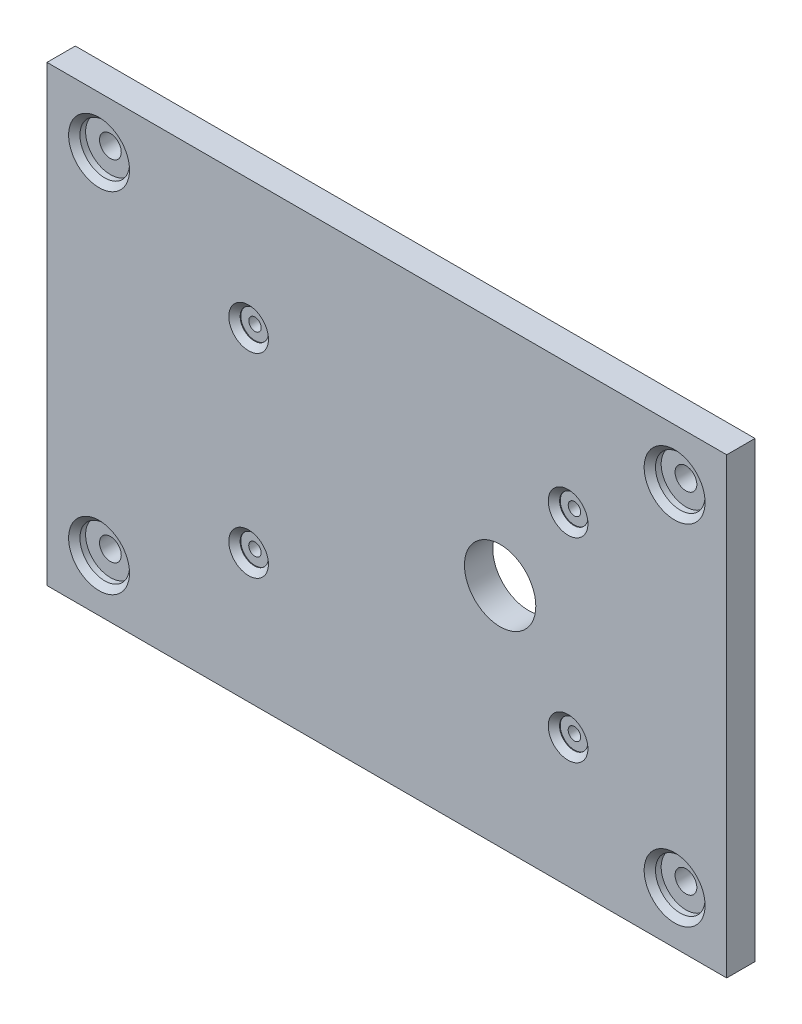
SolidWorks part; units mm, degrees
ref_plane "Front Plane" through (0, 0, 0) normal (0, 0, 1) x (1, 0, 0)
ref_plane "Top Plane" through (0, 0, 0) normal (0, 1, 0) x (1, 0, 0)
ref_plane "Right Plane" through (0, 0, 0) normal (1, 0, 0) x (0, 0, -1)
sketch "Sketch1" plane through (0, 0, 0) normal (0, 0, 1) x (1, 0, 0)
  line L1 (0, 0) -> (76.2, 0)
  line L2 (0, 0) -> (0, 50.8)
  line L3 (0, 50.8) -> (76.2, 50.8)
  line L4 (76.2, 0) -> (76.2, 50.8)
  dimension "D1" = 50.8
  dimension "D2" = 76.2
extrude "Boss-Extrude1" add sketch "Sketch1" along normal blind 3.175
sketch "Sketch2" plane through (0, 0, 3.175) normal (0, 0, 1) x (1, 0, 0)
  line L0 (0, 50.8) -> (5.8372, 44.9628)
  line L1 (76.2, 50.8) -> (70.3628, 44.9628)
  line L2 (0, 0) -> (5.8372, 5.8372)
  line L3 (76.2, 0) -> (70.3628, 5.8372)
  point P1 (5.8372, 44.9628)
  point P4 (70.3628, 44.9628)
  point P7 (5.8372, 5.8372)
  point P10 (70.3628, 5.8372)
  dimension "D1" = 8.255
hole_wizard "CBORE for #2 Binding Head Machine Screw1" positions "Sketch2" profile "Sketch3" counterbore size "#2" standard "ANSI Inch"
sketch "Sketch3" plane through (70.3628, 5.8372, 3.175) normal (1, 0, 0) x (0, -1, 0)
  line L0 (0, 0) -> (0, 13.4326)
  line L1 (0, 13.4326) -> (1.2192, 12.7)
  line L2 (1.2192, 12.7) -> (1.2192, 1.27)
  line L3 (1.2192, 1.27) -> (2.7788, 1.27)
  line L5 (2.7788, 1.27) -> (2.7788, 0.635)
  line L6 (2.7788, 0.635) -> (3.4138, 0)
  line L7 (3.4138, 0) -> (0, 0)
  line L8 (-2.7788, 0.635) -> (-3.4138, 0) construction
  line L10 (0, 13.4326) -> (-1.2192, 12.7) construction
  line L11 (0, -6.35) -> (0, 107.95) construction
  dimension "Hole Dia." = 2.4384
  dimension "Hole Depth" = 12.7
  dimension "C'Bore Dia." = 5.5575
  dimension "C'Bore Depth" = 1.27
  dimension "Near C'Sink Dia." = 6.8275
  dimension "Near C'Sink Angle" = 90
  dimension "Drill Angle" = 118
sketch "Sketch4" plane through (0, 0, 3.175) normal (0, 0, 1) x (1, 0, 0)
  line L0 (76.2, 25.4) -> (50.8, 25.4)
  line L1 (76.2, 0) -> (76.2, 50.8) construction
  circle A0 centre (50.8, 25.4) radius 4.0005
  dimension "D2" = 8.001
  dimension "D1" = 25.4
extrude "Cut-Extrude1" cut sketch "Sketch4" against normal through all contours A0
sketch "Sketch6" plane through (0, 0, 3.175) normal (0, 0, 1) x (1, 0, 0)
  line L0 (46.7995, 25.4) -> (50.8, 25.4)
  line L1 (50.8, 25.4) -> (22.6068, 36.3241)
  line L2 (22.6068, 36.3241) -> (50.8, 25.4)
  line L3 (50.8, 25.4) -> (22.603, 14.4857)
  line L4 (50.8, 25.4) -> (58.4214, 36.321)
  line L5 (91.1289, 44.3122) -> (99.6459, 22.3265)
  line L6 (99.6459, 22.3265) -> (110.5679, 50.5205)
  line L7 (88.7239, 14.7065) -> (99.6459, 22.3265)
  line L8 (99.6459, 22.3265) -> (110.5679, 14.7065)
  line L9 (99.6459, 22.3265) -> (87.636, 22.3265)
  line L10 (50.8, 25.4) -> (58.4176, 14.4763)
  line L11 (99.6459, 22.3265) -> (99.6459, 30.0023)
  circle A0 centre (50.8, 25.4) radius 4.0005 construction
  point P4 (22.6068, 36.3241)
  point P6 (22.603, 14.4857)
  point P14 (58.4214, 36.321)
  point P15 (58.4176, 14.4763)
  dimension "D1" = 30.2356
  dimension "D2" = 23.5778
  dimension "D3" = 13.3175
  dimension "D4" = 13.3175
  dimension "D5" = 68.824
  dimension "D6" = 42.351
  dimension "D7" = 103.727
  dimension "D8" = 110.195
  dimension "D9" = 103.73
  dimension "D10" = 110.2
  dimension "D11" = 103.73
  dimension "D12" = 21.18
hole_wizard "CBORE for #00 Binding Head Machine Screw1" positions "Sketch6" profile "Sketch7" counterbore size "#00" standard "ANSI Inch"
sketch "Sketch7" plane through (58.4176, 14.4763, 3.175) normal (1, 0, 0) x (0, -1, 0)
  line L0 (0, 0) -> (0, 13.1197)
  line L1 (0, 13.1197) -> (0.6985, 12.7)
  line L2 (0.6985, 12.7) -> (0.6985, 0.7112)
  line L3 (0.6985, 0.7112) -> (1.5875, 0.7112)
  line L5 (1.5875, 0.7112) -> (1.5875, 0.635)
  line L6 (1.5875, 0.635) -> (2.2225, 0)
  line L7 (2.2225, 0) -> (0, 0)
  line L8 (-1.5875, 0.635) -> (-2.2225, 0) construction
  line L10 (0, 13.1197) -> (-0.6985, 12.7) construction
  line L11 (0, -6.35) -> (0, 107.95) construction
  dimension "Hole Dia." = 1.397
  dimension "Hole Depth" = 12.7
  dimension "C'Bore Dia." = 3.175
  dimension "C'Bore Depth" = 0.7112
  dimension "Near C'Sink Dia." = 4.445
  dimension "Near C'Sink Angle" = 90
  dimension "Drill Angle" = 118
